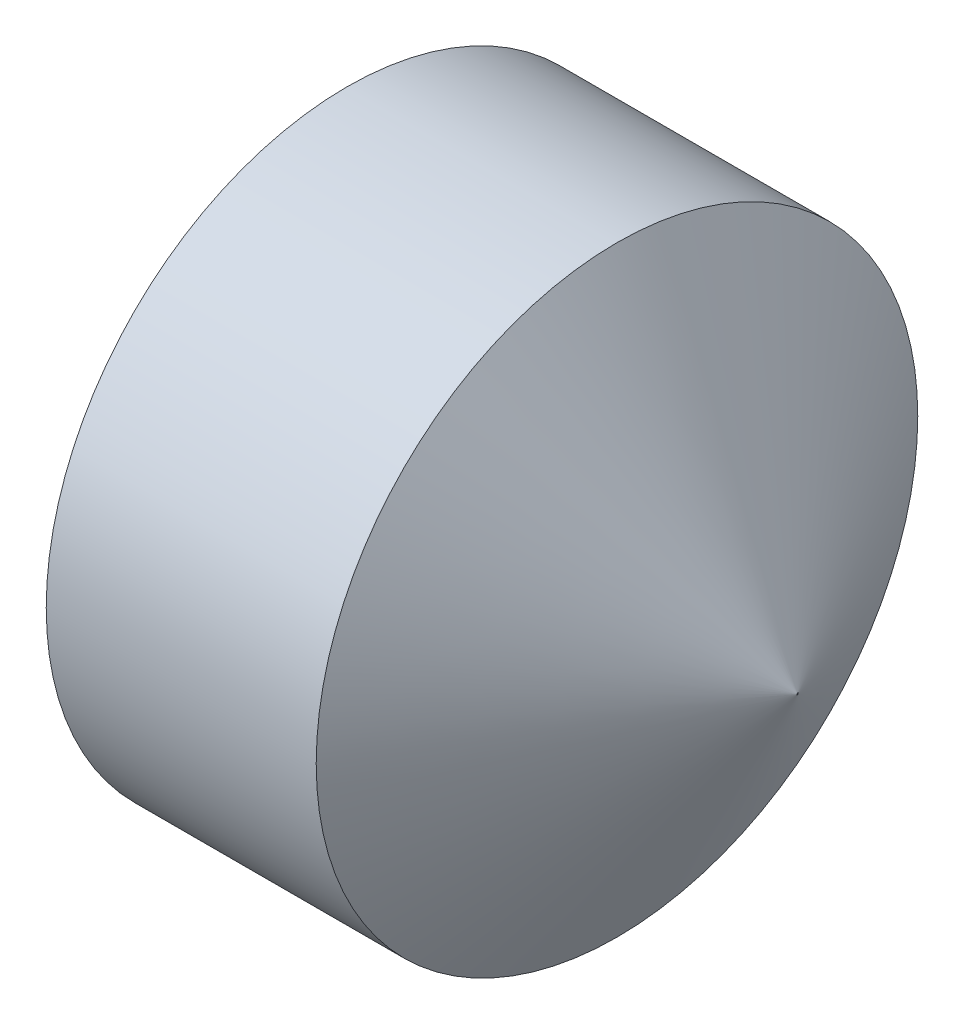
SolidWorks part; units mm, degrees
ref_plane "Plane1" through (0, 0, 0) normal (0, 0, 1) x (1, 0, 0)
ref_plane "Plane2" through (0, 0, 0) normal (0, 1, 0) x (1, 0, 0)
ref_plane "Plane3" through (0, 0, 0) normal (1, 0, 0) x (0, 0, -1)
sketch "BodySke" plane through (0, 0, 0) normal (0, 0, 1) x (1, 0, 0)
  line L0 (0, 0) -> (0, 2.055)
  line L1 (0, 2.055) -> (0.2569, 2.5)
  line L2 (0.2569, 2.5) -> (2.5009, 2.5)
  line L3 (4, 0) -> (4, 0.005)
  line L4 (4, 0) -> (0, 0)
  line L5 (-12.7, 0) -> (88.9, 0) construction
  line L6 (4, 0.005) -> (2.5009, 2.5)
  line L7 (0.8, 15.875) -> (0.8, -3.175) construction
  line L8 (0, -2.055) -> (0.2569, -2.5) construction
  line L9 (4, -0.005) -> (2.5009, -2.5) construction
  dimension "Cone_ang" = 118
  dimension "Length" = 4
  dimension "Diameter" = 5
  dimension "Drive_ch_ang" = 60
  dimension "Minor_dia" = 4.11
  dimension "Advance" = 0.8
  dimension "Tip_dia" = 0.01
revolve "BaseBody" add sketch "BodySke" angle 360 about L5
sketch "Sketch2" plane through (0, 0, 0) normal (-1, 0, 0) x (0, 0, 1)
  line L0 (0.7217, 1.25) -> (-0.7217, 1.25)
  line L1 (-0.7217, 1.25) -> (-1.4434, 0)
  line L2 (0.7217, 1.25) -> (1.4434, 0)
  line L3 (0.7217, -1.25) -> (1.4434, 0)
  line L4 (0.7217, -1.25) -> (-0.7217, -1.25)
  line L5 (-0.7217, -1.25) -> (-1.4434, 0)
  dimension "Hex_size" = 2.5
  dimension "D2" = 1.25
  dimension "D3" = 1.25
extrude "Hex" cut sketch "Sketch2" against normal blind 1.2
sketch "Sketch4" plane through (0, 4.7709, -0.5249) normal (-1, 0, 0) x (0, 0, 1)
  line L0 (0.5249, -4.7709) -> (1.9854, -4.7709)
  line L1 (0.5249, -4.7709) -> (6.6732, -1.2211) construction
  line L2 (0.5249, -4.7709) -> (1.2551, -3.506)
  line L3 (1.7257, -4.4442) -> (1.9182, -4.333)
  line L4 (1.4082, -3.8943) -> (1.6007, -3.7831)
  arc A0 (1.7257, -4.4442) -> (1.4082, -3.8943) centre (0.5249, -4.7709) ccw
  arc A1 (1.9854, -4.7709) -> (1.9182, -4.333) centre (0.5249, -4.7709) ccw
  arc A2 (1.2551, -3.506) -> (1.6007, -3.7831) centre (0.5249, -4.7709) cw
  circle A3 centre (0.5249, -4.7709) radius 1.2445 construction
  circle A4 centre (0.5249, -4.7709) radius 1.4605 construction
  dimension "D1" = 30
  dimension "Spline_n_dim" = 2.489
  dimension "Spline_m_dim" = 2.921
  dimension "Spline_a_dim" = 60
  dimension "D3" = 0.3175
  dimension "Spline_p_dim" = 0.635
extrude "Spline6" [suppressed] cut sketch "Sketch4" against normal blind 1.2
pattern_circular "CirPattern1" [suppressed] count 6 every 60 about axis through (-12.7, 0, 0) along (1, 0, 0)
sketch "Sketch5" plane through (0, 1.4735, 6.925) normal (-1, 0, 0) x (0, 0, 1)
  line L0 (-6.925, -1.4735) -> (-5.4645, -1.4735)
  line L1 (-6.925, -1.4735) -> (-1.9049, 3.5466) construction
  line L2 (-6.925, -1.4735) -> (-6.925, -0.013)
  line L3 (-5.8205, -0.818) -> (-5.6925, -0.69)
  line L4 (-6.2696, -0.369) -> (-6.1415, -0.241)
  line L5 (-6.2696, -0.369) -> (-5.8205, -0.818)
  arc A1 (-5.4645, -1.4735) -> (-5.6925, -0.69) centre (-6.925, -1.4735) ccw
  arc A2 (-6.925, -0.013) -> (-6.1415, -0.241) centre (-6.925, -1.4735) cw
  circle A3 centre (-6.925, -1.4735) radius 1.2445 construction
  circle A4 centre (-6.925, -1.4735) radius 1.4605 construction
  dimension "D1" = 45
  dimension "Spline_n_dim" = 2.489
  dimension "Spline_m_dim" = 2.921
  dimension "Spline_a_dim" = 90
  dimension "D3" = 0.3175
  dimension "Spline_p_dim" = 0.635
extrude "Spline4" [suppressed] cut sketch "Sketch5" against normal blind 1.2
pattern_circular "CirPattern2" [suppressed] count 4 every 90 about axis through (-12.7, 0, 0) along (1, 0, 0)
sketch "ThdSchSke" plane through (0, 0, 0) normal (0, 0, 1) x (1, 0, 0)
  line L0 (0.2569, -2.055) -> (-0.0547, -2.5)
  line L1 (0.2569, -2.055) -> (0.5685, -2.5)
  line L2 (0.5685, -2.5) -> (0.5685, -3.125)
  line L3 (-3.175, 0) -> (5.1513, 0) construction
  line L4 (0.2569, 2.5) -> (0.2569, -2.5) construction
  line L5 (0.5685, -3.125) -> (-0.0547, -3.125)
  line L6 (-0.0547, -3.125) -> (-0.0547, -2.5)
  dimension "Thread_minor" = 4.11
  dimension "Diameter" = 5
  dimension "SideAngle" = 55
  dimension "VeeAngle" = 70
  dimension "Overcut" = 6.25
revolve "ThreadSchematic" [suppressed] cut sketch "ThdSchSke" angle 360 about L3
pattern_linear "ThdSchPat" [suppressed]
equation "\"D2@Sketch2\" = \"Hex_size@Sketch2\" / 2"
equation "\"D3@Sketch2\" = \"Hex_size@Sketch2\" / 2"
equation "\"Thread_minor@ThreadCosmetic\" = \"Minor_dia@BodySke\""
equation "\"D1@Sketch4\" = \"Spline_a_dim@Sketch4\" / 2"
equation "\"D3@Sketch4\" = \"Spline_p_dim@Sketch4\" / 2"
equation "\"D2@CirPattern1\" = \"Spline_a_dim@Sketch4\""
equation "\"Num_teeth@CirPattern1\" = 360 / \"D2@CirPattern1\""
equation "\"Spline_a_dim@Sketch5\" = 90"
equation "\"Spline_p_dim@Sketch5\" = \"Spline_p_dim@Sketch4\""
equation "\"Spline_m_dim@Sketch5\" = \"Spline_m_dim@Sketch4\""
equation "\"Spline_n_dim@Sketch5\" = \"Spline_n_dim@Sketch4\""
equation "\"D1@Sketch5\" = \"Spline_a_dim@Sketch5\" / 2"
equation "\"D3@Sketch5\" = \"Spline_p_dim@Sketch5\" / 2"
equation "\"Key_eng@Spline4\" = \"Key_eng@Spline6\""
equation "\"Thread_minor@ThdSchSke\" = \"Thread_minor@ThreadCosmetic\""
equation "\"Diameter@ThdSchSke\" = \"Diameter@BodySke\""
equation "\"Overcut@ThdSchSke\" = \"Diameter@BodySke\" * 1.25"
equation "\"Num_threads@ThdSchPat\" = int( (\"Length@BodySke\" - ( ( ( \"Diameter@BodySke\" - \"Minor_dia@BodySke\" ) * 0.5 ) / tan( \"Drive_ch_ang@BodySke\" * 0.017453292 ) ) - ( ( \"Diameter@BodySke\" * 0.5 ) / tan( \"Con"
equation "\"Num_threads@ThdSchPat\" = int( (\"Length@BodySke\" - ( ( ( \"Diameter@BodySke\" - \"Minor_dia@BodySke\" ) * 0.5 ) / tan( \"Drive_ch_ang@BodySke\" * 0.017453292 ) ) - ( (( \"Diameter@BodySke\" - \"Tip_dia@BodySke"
equation "\"Advance@ThdSchPat\" = (\"Length@BodySke\" - ( ( ( \"Diameter@BodySke\" - \"Minor_dia@BodySke\" ) * 0.5 ) / tan( \"Drive_ch_ang@BodySke\" * 0.017453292 ) ) - ( ( \"Diameter@BodySke\" * 0.5 ) / tan( \"Cone_ang@Bod"
equation "\"Advance@ThdSchPat\" = (\"Length@BodySke\" - ( ( ( \"Diameter@BodySke\" - \"Minor_dia@BodySke\" ) * 0.5 ) / tan( \"Drive_ch_ang@BodySke\" * 0.017453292 ) ) - ( ( (\"Diameter@BodySke\" - \"Tip_dia@BodySke\") * 0.5 "
equation "' \"Num_threads@ThdSchPat\" = \"Num_threads@ThdSchPat\" - sgn( \"Num_threads@ThdSchPat\" - 1) '---chamfered tips only---"
